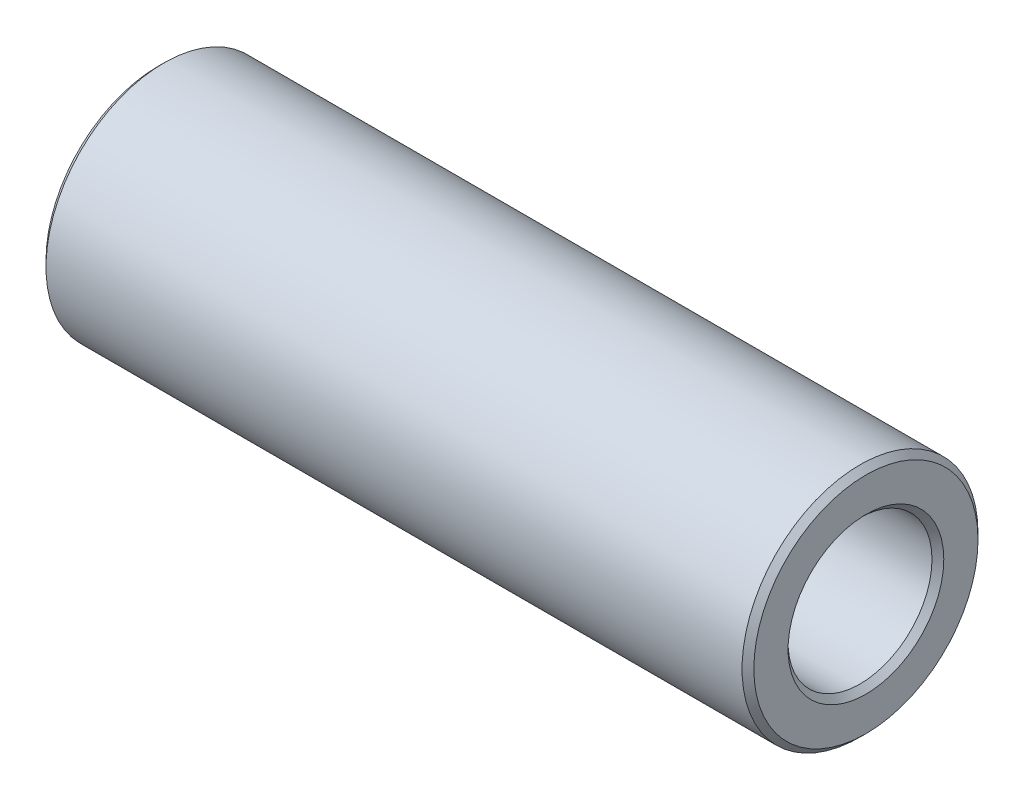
SolidWorks part; units mm, degrees
ref_plane "Спереди" through (0, 0, 0) normal (0, 0, 1) x (1, 0, 0)
ref_plane "Сверху" through (0, 0, 0) normal (0, 1, 0) x (1, 0, 0)
ref_plane "Справа" through (0, 0, 0) normal (1, 0, 0) x (0, 0, -1)
sketch "Эскиз1" plane through (0, 0, 0) normal (1, 0, 0) x (0, 0, -1)
  circle A0 centre (0, 0) radius 3.05
  circle A1 centre (0, 0) radius 5
  dimension "D1" = 6.1
  dimension "D2" = 10
extrude "Бобышка-Вытянуть1" add sketch "Эскиз1" along normal blind 30
chamfer "Фаска1" distance 0.25 angle 45 4 edges at (0, 0, -3.05) (30, 0, -3.05) (0, 0, -5) (30, 0, -5)
